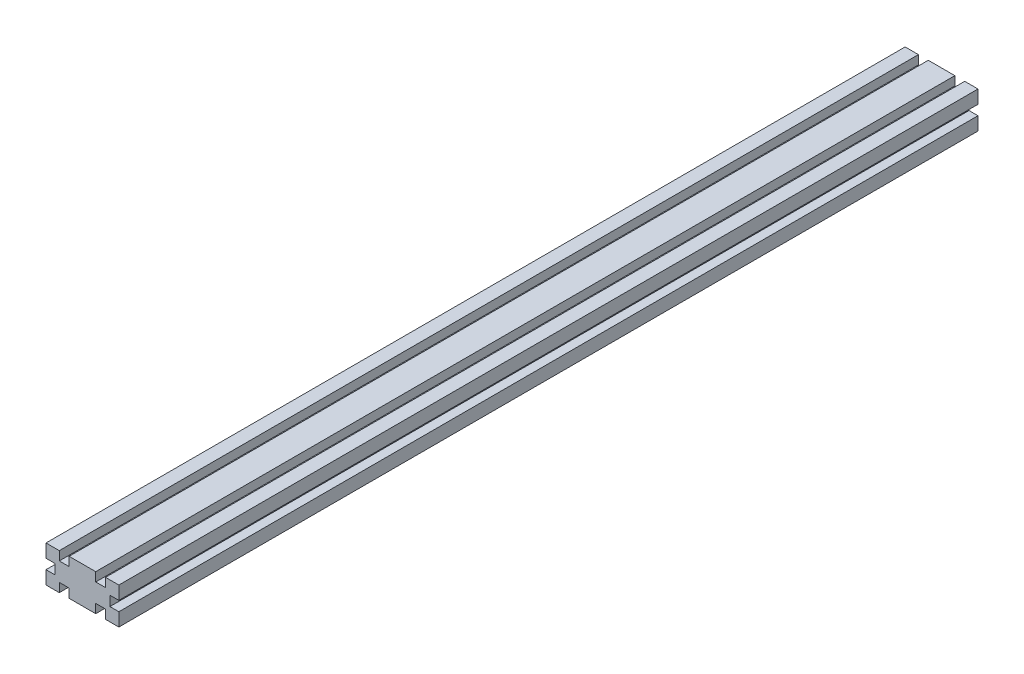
SolidWorks part; units mm, degrees
ref_plane "Ebene vorne" through (0, 0, 0) normal (0, 0, 1) x (1, 0, 0)
ref_plane "Ebene oben" through (0, 0, 0) normal (0, 1, 0) x (1, 0, 0)
ref_plane "Ebene rechts" through (0, 0, 0) normal (1, 0, 0) x (0, 0, -1)
sketch "Skizze1" plane through (0, 0, 0) normal (0, 0, 1) x (1, 0, 0)
  line L0 (0, 0) -> (0, 11.6)
  line L5 (0, 11.6) -> (7.8, 11.6)
  line L6 (11.6, 0) -> (11.6, 7.8)
  line L7 (11.6, 7.8) -> (20.2, 7.8)
  line L8 (20.2, 7.8) -> (20.2, 0)
  line L9 (0, 0) -> (11.6, 0)
  line L10 (20.2, 0) -> (31.8, 0)
  line L11 (7.8, 11.6) -> (7.8, 20.2)
  line L12 (7.8, 20.2) -> (0, 20.2)
  line L13 (0, 20.2) -> (0, 31.8)
  line L14 (0, 31.8) -> (11.6, 31.8)
  line L15 (11.6, 31.8) -> (11.6, 24)
  line L16 (11.6, 24) -> (20.2, 24)
  line L17 (20.2, 24) -> (20.2, 31.8)
  line L18 (20.2, 31.8) -> (31.8, 31.8)
  line L19 (31.8, 31.8) -> (31.8, 20.2)
  line L20 (31.8, 20.2) -> (24, 20.2)
  line L21 (24, 20.2) -> (24, 11.6)
  line L22 (24, 11.6) -> (31.8, 11.6)
  line L23 (31.8, 11.6) -> (31.8, 0)
  line L24 (0, 45.0634) -> (0, -21.2473) construction
  line L25 (-31.8, 0) -> (-31.8, 11.6)
  line L26 (-31.8, 11.6) -> (-24, 11.6)
  line L27 (-20.2, 0) -> (-20.2, 7.8)
  line L28 (-20.2, 7.8) -> (-11.6, 7.8)
  line L29 (-11.6, 7.8) -> (-11.6, 0)
  line L30 (-31.8, 0) -> (-20.2, 0)
  line L31 (-11.6, 0) -> (0, 0)
  line L32 (-24, 11.6) -> (-24, 20.2)
  line L33 (-24, 20.2) -> (-31.8, 20.2)
  line L34 (-31.8, 20.2) -> (-31.8, 31.8)
  line L35 (-31.8, 31.8) -> (-20.2, 31.8)
  line L36 (-20.2, 31.8) -> (-20.2, 24)
  line L37 (-20.2, 24) -> (-11.6, 24)
  line L38 (-11.6, 24) -> (-11.6, 31.8)
  line L39 (-11.6, 31.8) -> (0, 31.8)
  line L40 (0, 31.8) -> (0, 20.2)
  line L41 (0, 20.2) -> (-7.8, 20.2)
  line L42 (-7.8, 20.2) -> (-7.8, 11.6)
  line L43 (-7.8, 11.6) -> (0, 11.6)
  line L44 (0, 11.6) -> (0, 0)
  dimension "D1" = 7.8
  dimension "D2" = 11.6
  dimension "D3" = 8.6
  dimension "D4" = 8.6
  dimension "D5" = 7.8
  dimension "D6" = 11.6
extrude "Aufsatz-Linear austragen1" add sketch "Skizze1" along normal blind 750 contours L43 L42 L41 L13 L39 L38 L37 L36 L35 L34 L33 L32 L26 L25 L30 L27 L28 L29 L31 L0 | L24 L41 L42 L43 | L12 L24 L5 L11 | L23 L22 L21 L20 L19 L18 L17 L16 L15 L14 L13 L12 L11 L5 L0 L9 L6 L7 L8 L10
